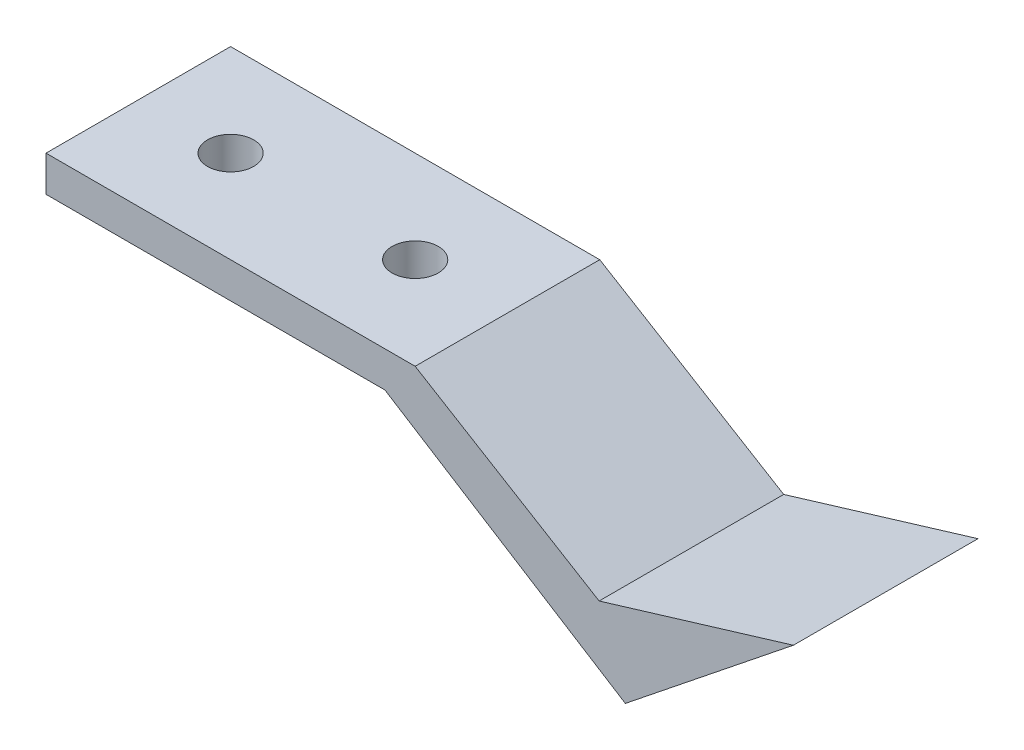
SolidWorks part; units mm, degrees
ref_plane "Front" through (0, 0, 0) normal (0, 0, 1) x (1, 0, 0)
ref_plane "Top" through (0, 0, 0) normal (0, 1, 0) x (1, 0, 0)
ref_plane "Right" through (0, 0, 0) normal (1, 0, 0) x (0, 0, -1)
sketch "스케치1" plane through (0, 0, 0) normal (0, 0, 1) x (1, 0, 0)
  line L0 (10.6189, -1.2273) -> (27.1609, -11.6328)
  line L1 (10.6189, -1.2273) -> (-12.7, -1.2273)
  line L3 (12.7, 1.2273) -> (-12.7, 1.2273)
  line L4 (-12.7, -1.2273) -> (-12.7, 1.2273)
  line L7 (27.1609, -11.6328) -> (38.7244, -2.3835)
  line L8 (38.7244, -2.3835) -> (25.3573, -6.43)
  line L9 (25.3573, -6.43) -> (12.7, 1.2273)
  point P0 (0, 0)
  point P2 (38.7244, -2.3835)
  dimension "D1" = 25.4
extrude "보스-돌출1" add sketch "스케치1" along normal blind 12.7
sketch "스케치2" plane through (0, 1.2273, 0) normal (0, 1, 0) x (1, 0, 0)
  line L0 (-12.7, -12.7) -> (-12.7, 0) construction
  line L1 (12.7, 0) -> (-12.7, 0) construction
  circle A0 centre (-6.35, -6.35) radius 1.5875
  circle A1 centre (6.35, -6.35) radius 1.5875
  dimension "D1" = 6.35
  dimension "D3" = 3.175
  dimension "D4" = 3.175
  dimension "D2" = 12.7
  dimension "D5" = 6.35
  dimension "D6" = 6.35
extrude "컷-돌출1" cut sketch "스케치2" against normal blind 12.7
